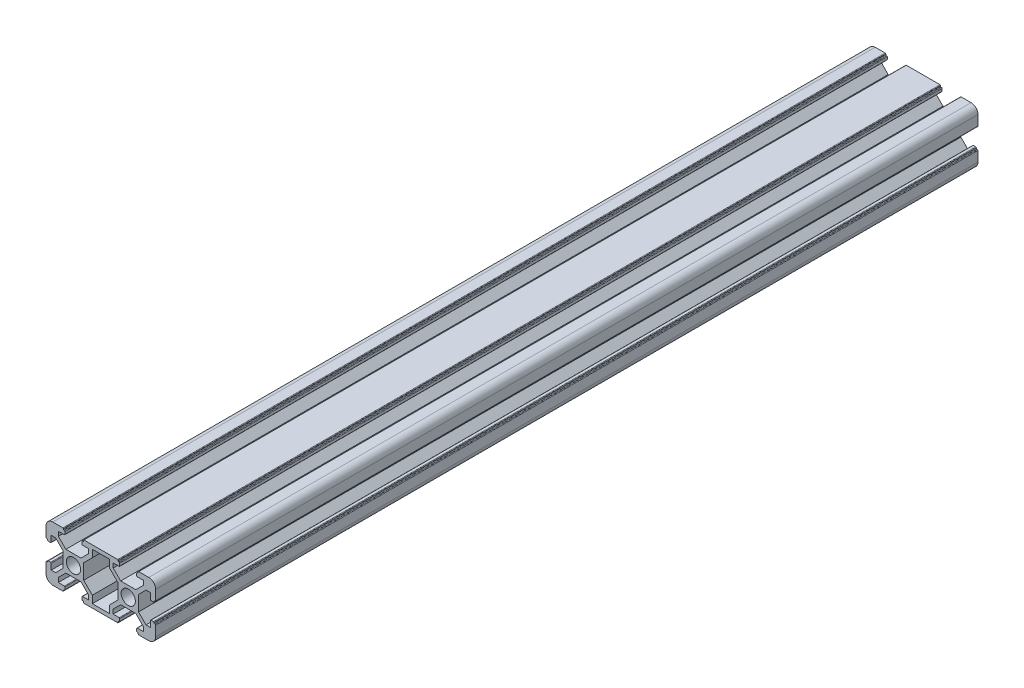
SolidWorks part; units mm, degrees
ref_plane "前视基准面" through (0, 0, 0) normal (0, 0, 1) x (1, 0, 0)
ref_plane "上视基准面" through (0, 0, 0) normal (0, 1, 0) x (1, 0, 0)
ref_plane "右视基准面" through (0, 0, 0) normal (1, 0, 0) x (0, 0, -1)
sketch "草图1"
sketch_block_instance "A$C495611E1-1"
sketch_block "A$C495611E1"
extrude "凸台-拉伸1" add sketch "草图1" along normal mid plane 300
